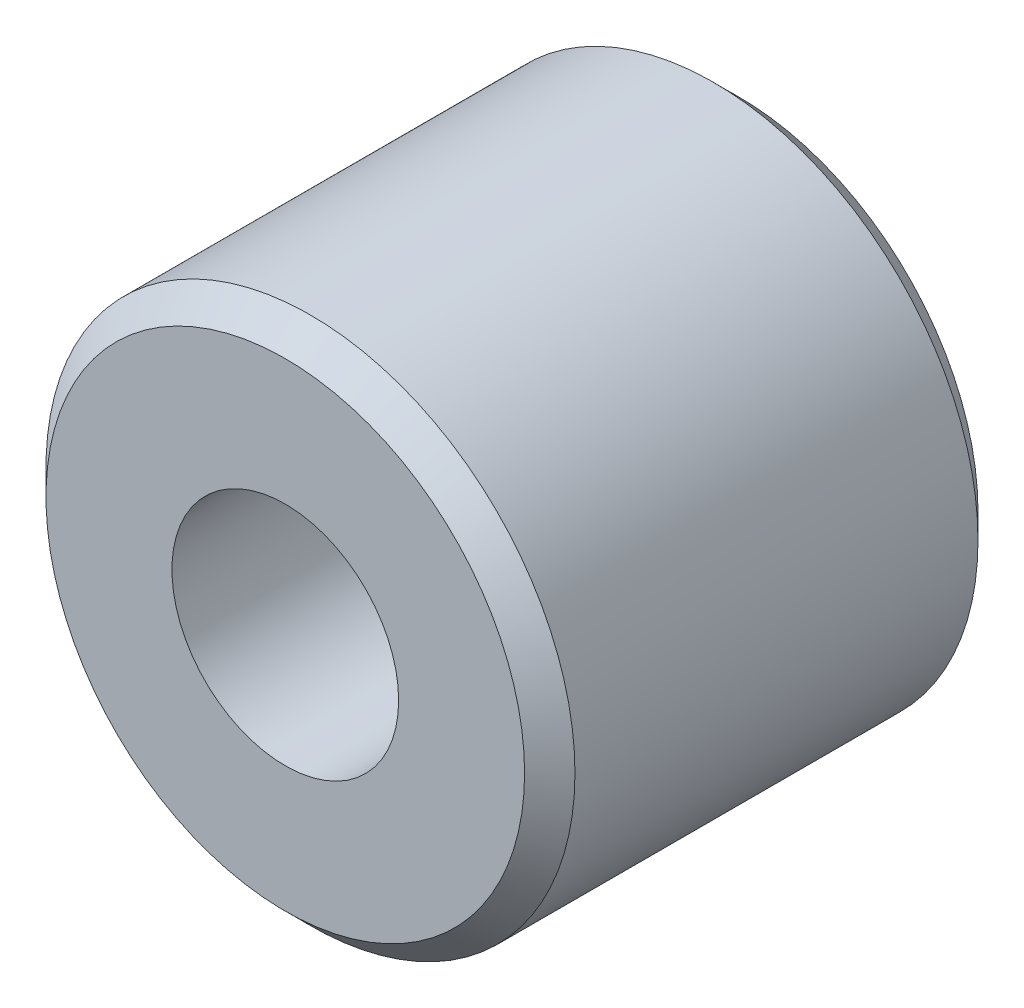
SolidWorks part; units mm, degrees
ref_plane "Plan de face" through (0, 0, 0) normal (0, 0, 1) x (1, 0, 0)
ref_plane "Plan de dessus" through (0, 0, 0) normal (0, 1, 0) x (1, 0, 0)
ref_plane "Plan de droite" through (0, 0, 0) normal (1, 0, 0) x (0, 0, -1)
sketch "Esquisse1" plane through (0, 0, 0) normal (0, 0, 1) x (1, 0, 0)
  circle A0 centre (0, 0) radius 21
  circle A1 centre (0, 0) radius 9
  dimension "D1" = 42
  dimension "D2" = 18
extrude "Extrusion1" add sketch "Esquisse1" along normal blind 36
chamfer "Chanfrein1" distance 2 angle 45 2 edges at (21, 0, 0) (21, 0, 36)
